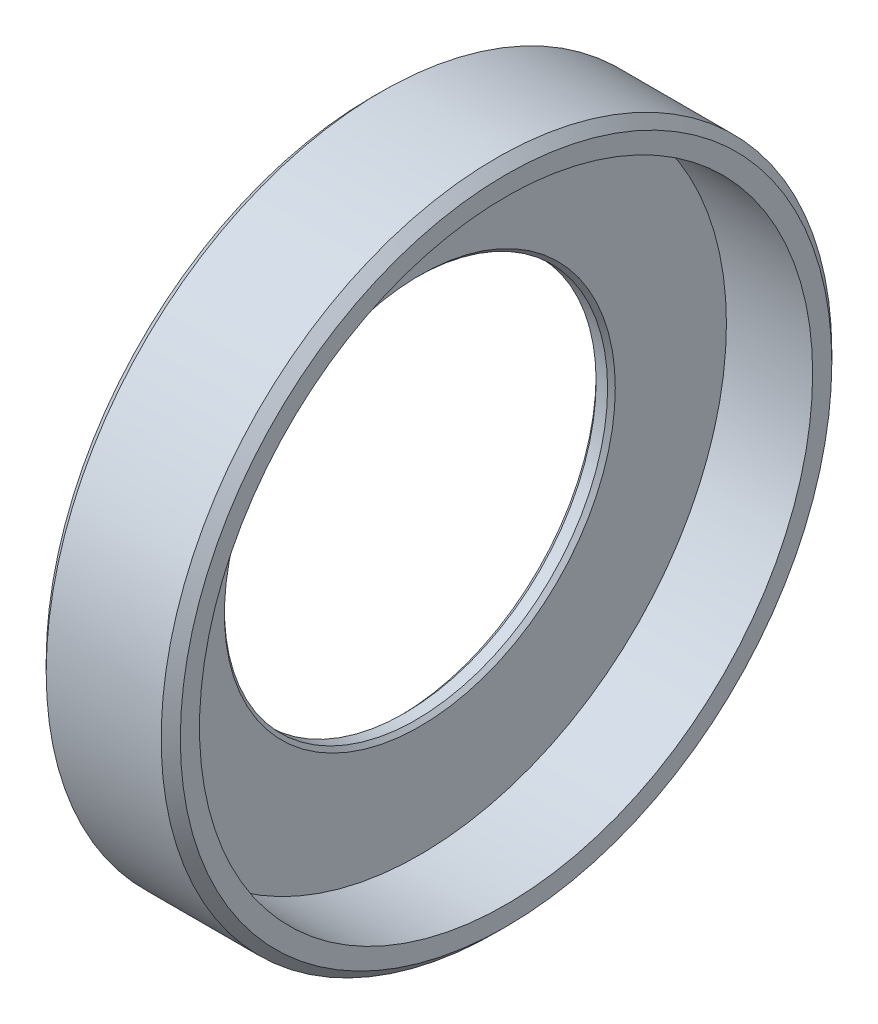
SolidWorks part; units mm, degrees
ref_plane "Front" through (0, 0, 0) normal (0, 0, 1) x (1, 0, 0)
ref_plane "Top" through (0, 0, 0) normal (0, 1, 0) x (1, 0, 0)
ref_plane "Right" through (0, 0, 0) normal (1, 0, 0) x (0, 0, -1)
sketch "Sketch1" plane through (0, 0, 0) normal (0, 1, 0) x (1, 0, 0)
  line L0 (0, 0) -> (-43.2584, 0) construction
  line L1 (0, 17.5) -> (0, 15)
  line L2 (0, 15) -> (1.5, 10)
  line L3 (1.5, 10) -> (2.5, 10)
  line L4 (2.5, 10) -> (2.5, 16)
  line L5 (2.5, 16) -> (7, 16)
  line L8 (7, 16) -> (7, 17.5)
  line L9 (7, 17.5) -> (0, 17.5)
  dimension "D1" = 20
  dimension "D2" = 35
  dimension "D3" = 30
  dimension "D4" = 7
  dimension "D5" = 32
  dimension "D6" = 4.5
  dimension "D7" = 1
revolve "Revolve1" add sketch "Sketch1" angle 360 about L0
chamfer "Chamfer1" distance 0.5 angle 45 2 edges at (0, 0, -17.5) (7, 0, -17.5)
chamfer "Chamfer2" distance 0.2 angle 45 2 edges at (1.5, 0, -10) (2.5, 0, -10)
